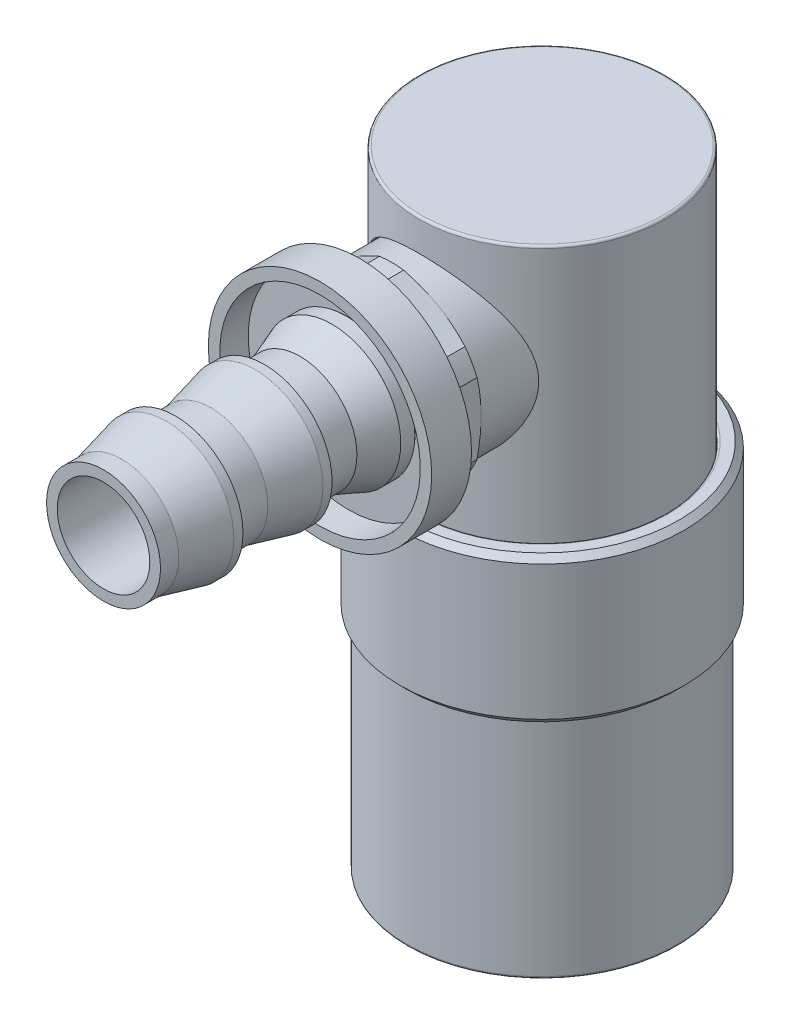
SolidWorks part; units mm, degrees
other "BODY_"
ref_plane "Front Plane" through (0, 0, 0) normal (0, 0, 1) x (1, 0, 0)
ref_plane "Top Plane" through (0, 0, 0) normal (0, 1, 0) x (1, 0, 0)
ref_plane "Right Plane" through (0, 0, 0) normal (1, 0, 0) x (0, 0, -1)
imported_body "SLEEVE"
imported_body "SC200S"
imported_body "BODY"
imported_body "BARB"
imported_body "PL-BARB"
sketch "Sketch1" plane through (0, 0, 0) normal (0, -1, 0) x (1, 0, 0)
  circle A0 centre (0, 0) radius 10.287
  circle A1 centre (0, 0) radius 7.9375
  dimension "D1" = 15.875
extrude "Boss-Extrude1" add sketch "Sketch1" against normal up to surface (17.3228 mm away)
sketch "Sketch2" plane through (0, 0, 0) normal (0, -1, 0) x (1, 0, 0)
  line L1 (11.1452, 0) -> (5.5726, 9.652)
  line L2 (5.5726, 9.652) -> (-5.5726, 9.652)
  line L3 (-5.5726, 9.652) -> (-11.1452, 0)
  line L4 (-11.1452, 0) -> (-5.5726, -9.652)
  line L5 (-5.5726, -9.652) -> (5.5726, -9.652)
  line L6 (5.5726, -9.652) -> (11.1452, 0)
  circle A0 centre (0, 0) radius 9.652 construction
  dimension "D1" = 19.304
extrude "Cut-Extrude1" cut sketch "Sketch2" against normal up to surface (18.181 mm away)
